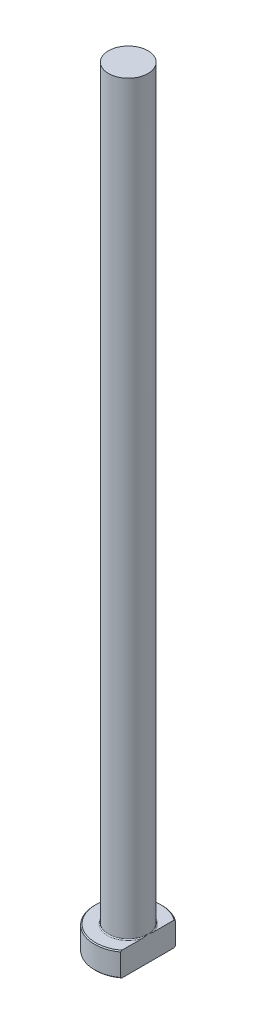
SolidWorks part; units mm, degrees
ref_plane "Front Plane" through (0, 0, 0) normal (0, 0, 1) x (1, 0, 0)
ref_plane "Top Plane" through (0, 0, 0) normal (0, 1, 0) x (1, 0, 0)
ref_plane "Right Plane" through (0, 0, 0) normal (1, 0, 0) x (0, 0, -1)
sketch "Sketch1" plane through (0, 0, 0) normal (0, 0, 1) x (1, 0, 0)
  line L0 (0, 259.9588) -> (0, -15.1925) construction
  line L1 (0, 0) -> (-7, 0)
  line L2 (-7, 0) -> (-7, 5)
  line L3 (-7, 5) -> (-4.1, 5)
  line L4 (-4.1, 5) -> (-4.1, 160)
  line L5 (-4.1, 160) -> (0, 160)
  line L6 (0, 160) -> (0, 0)
  dimension "L" = 160
  dimension "H" = 14
  dimension "T" = 5
  dimension "D" = 8.2
revolve "Revolve1" add sketch "Sketch1" angle 360 about L0
chamfer "Chamfer1" distance 0.2 angle 45 2 edges at (0, 5, 7) (0, 0, 7)
fillet "Fillet1" radius 0.2 1 edges at (0, 5, 4.1)
sketch "Sketch2" plane through (0, 0, 0) normal (0, 1, 0) x (1, 0, 0)
  line L0 (4.1, 5.6736) -> (4.1, -5.6736)
  circle A0 centre (0, 0) radius 7 construction
  arc A1 (4.1, -5.6736) -> (4.1, 5.6736) centre (0, 0) ccw
  circle A2 centre (0, 0) radius 4.1 construction
extrude "KEY" cut sketch "Sketch2" along normal through all
